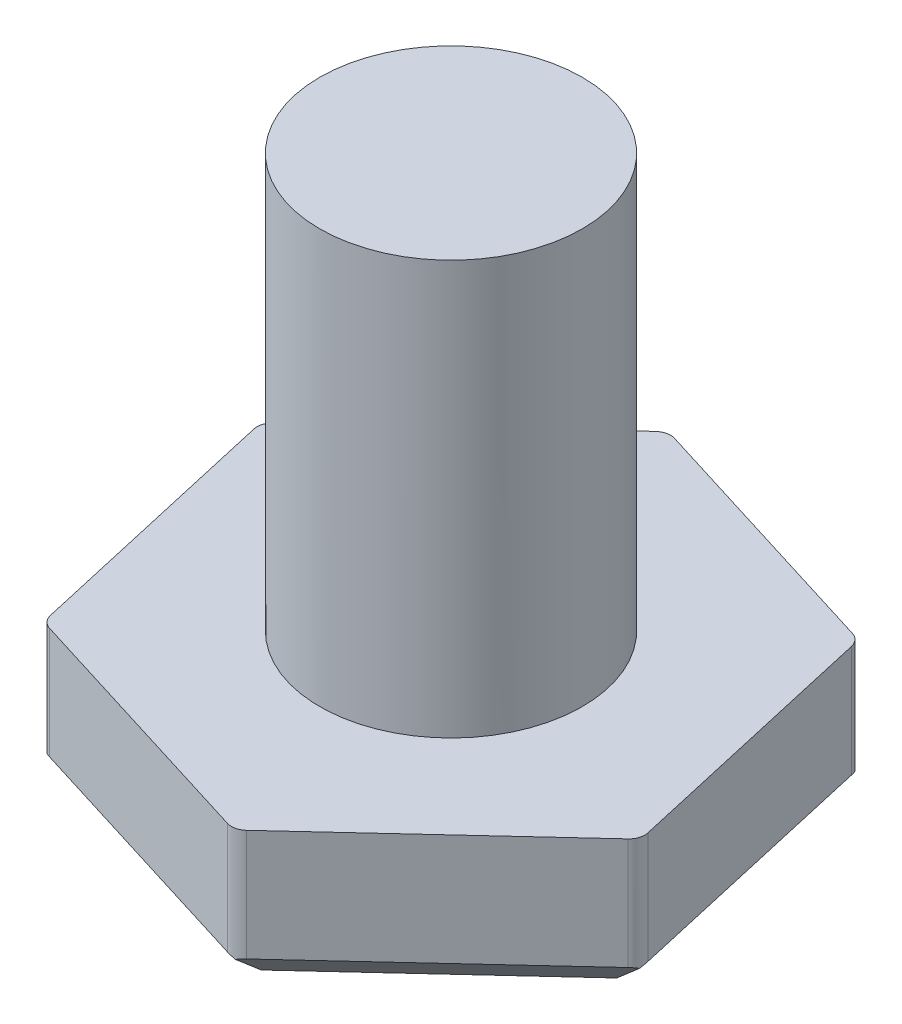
SolidWorks part; units mm, degrees
ref_plane "Front Plane" through (0, 0, 0) normal (0, 0, 1) x (1, 0, 0)
ref_plane "Top Plane" through (0, 0, 0) normal (0, 1, 0) x (1, 0, 0)
ref_plane "Right Plane" through (0, 0, 0) normal (1, 0, 0) x (0, 0, -1)
sketch "Sketch1"
  dimension "D1" = 4.1907
extrude "Extrude1" add sketch "Sketch1" along normal blind 6.604
sketch "Sketch2"
extrude "Extrude2" add sketch "Sketch2" along normal blind 2.286
chamfer "Chamfer1" distance 0.508 angle 45 6 edges at (-3.8868, -2.286, 0.8809) (-2.7063, -2.286, -2.9256) (1.1805, -2.286, -3.8066) (3.8868, -2.286, -0.8809) (2.7063, -2.286, 2.9256) (-1.1805, -2.286, 3.8066)
fillet "Fillet1" radius 0.254 6 edges at (-3.3782, -0.889, 3.125) (-4.3955, -0.889, -1.3631) (-1.0172, -0.889, -4.4881) (3.3782, -0.889, -3.125) (4.3955, -0.889, 1.3631) (1.0172, -0.889, 4.4881)
